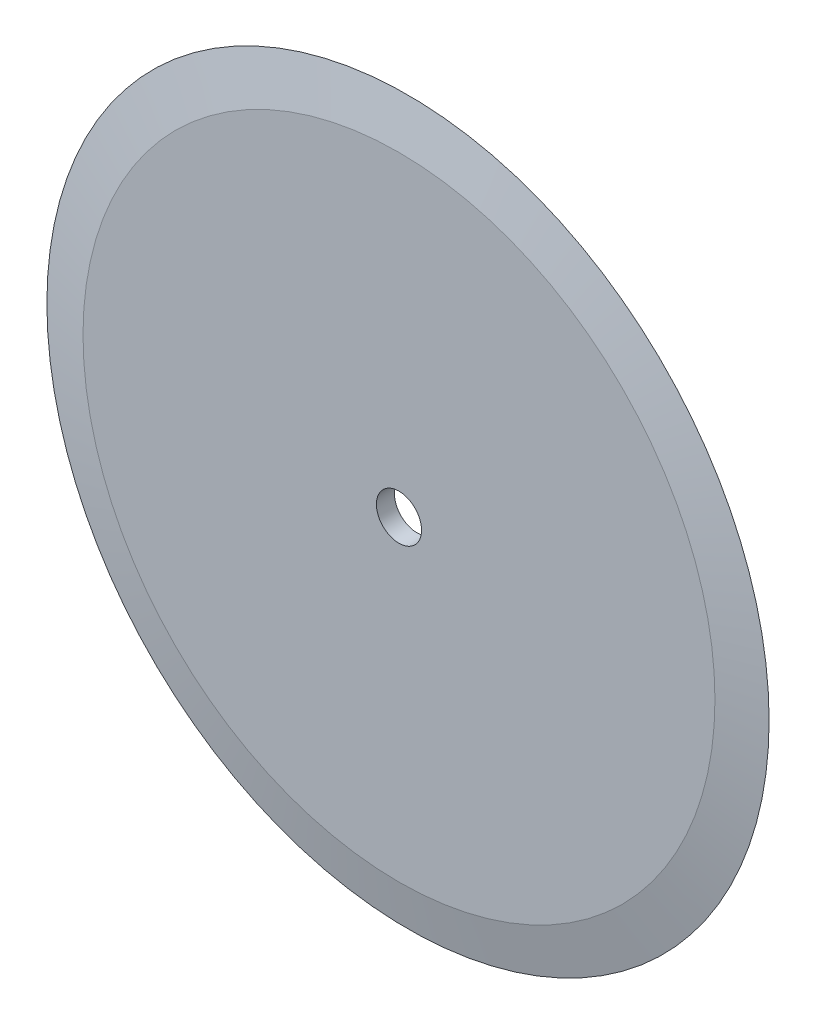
SolidWorks part; units mm, degrees
ref_plane "Front" through (0, 0, 0) normal (0, 0, 1) x (1, 0, 0)
ref_plane "Top" through (0, 0, 0) normal (0, 1, 0) x (1, 0, 0)
ref_plane "Right" through (0, 0, 0) normal (1, 0, 0) x (0, 0, -1)
sketch "Esquisse1" plane through (0, 0, 0) normal (0, 0, 1) x (1, 0, 0)
  circle A0 centre (0, 0) radius 40
  circle A1 centre (0, 0) radius 2.5
  dimension "D1" = 80
  dimension "D2" = 5
extrude "Boss.-Extru.1" add sketch "Esquisse1" along normal mid plane 2
chamfer "Chanfrein1" distance 1 distance2 5 2 edges at (40, 0, -1) (40, 0, 1)
